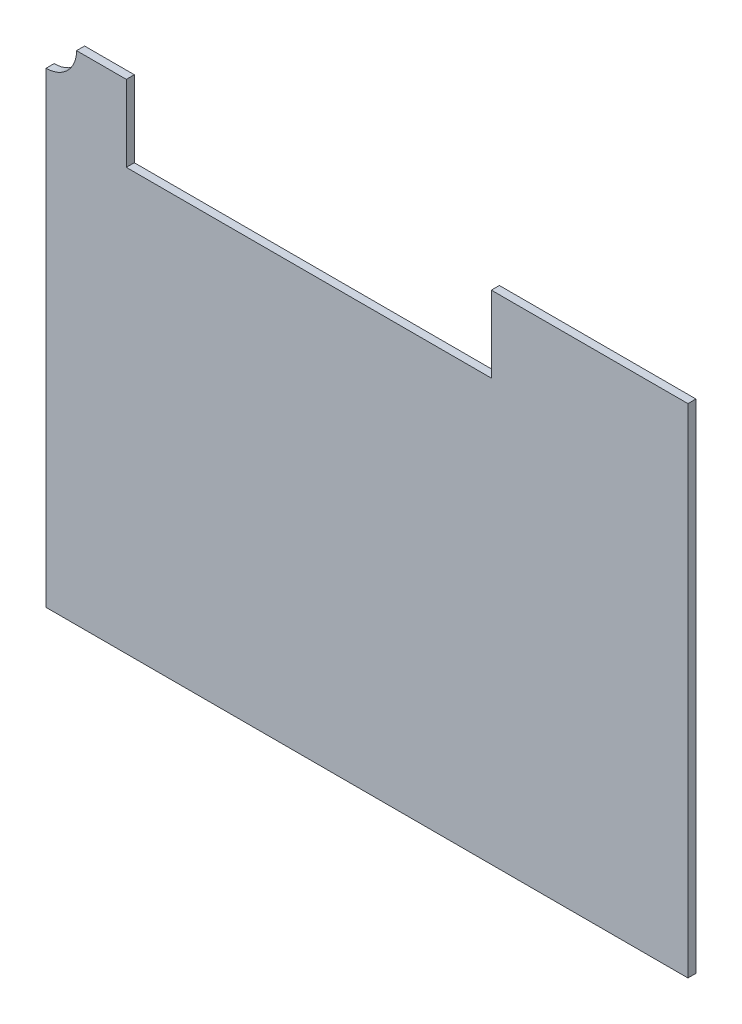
SolidWorks part; units mm, degrees
ref_plane "Plan de face" through (0, 0, 0) normal (0, 0, 1) x (1, 0, 0)
ref_plane "Plan de dessus" through (0, 0, 0) normal (0, 1, 0) x (1, 0, 0)
ref_plane "Plan de droite" through (0, 0, 0) normal (1, 0, 0) x (0, 0, -1)
sketch "Esquisse1" plane through (0, 0, 0) normal (0, 0, 1) x (1, 0, 0)
  line L0 (-54.2603, -17.2555) -> (25.7397, -17.2555)
  line L1 (25.7397, -17.2555) -> (25.7397, 44.7445)
  line L2 (25.7397, 44.7445) -> (1.2397, 44.7445)
  line L3 (1.2397, 44.7445) -> (1.2397, 35.2445)
  line L4 (1.2397, 35.2445) -> (-44.2603, 35.2445)
  line L5 (-44.2603, 35.2445) -> (-44.2603, 44.7445)
  line L6 (-44.2603, 44.7445) -> (-54.2603, 44.7445)
  line L7 (-54.2603, 44.7445) -> (-54.2603, -17.2555)
  dimension "D1" = 62
  dimension "D2" = 24.5
  dimension "D3" = 80
  dimension "D4" = 10
  dimension "D5" = 52.5
extrude "Extrusion1" add sketch "Esquisse1" along normal blind 1
sketch "Esquisse2" plane through (0, 0, 1) normal (0, 0, 1) x (1, 0, 0)
  line L0 (-54.2603, 44.7445) -> (-54.2603, -17.2555) construction
  line L1 (-44.2603, 44.7445) -> (-54.2603, 44.7445) construction
  line L2 (-54.2603, 44.7445) -> (-54.2603, 40.9418)
  line L3 (-54.2603, 44.7445) -> (-50.4576, 44.7445)
  arc A1 (-54.2603, 40.9418) -> (-50.4576, 44.7445) centre (-54.2603, 44.7445) ccw
extrude "Enlèv. mat.-Extru.1" cut sketch "Esquisse2" against normal blind 1
